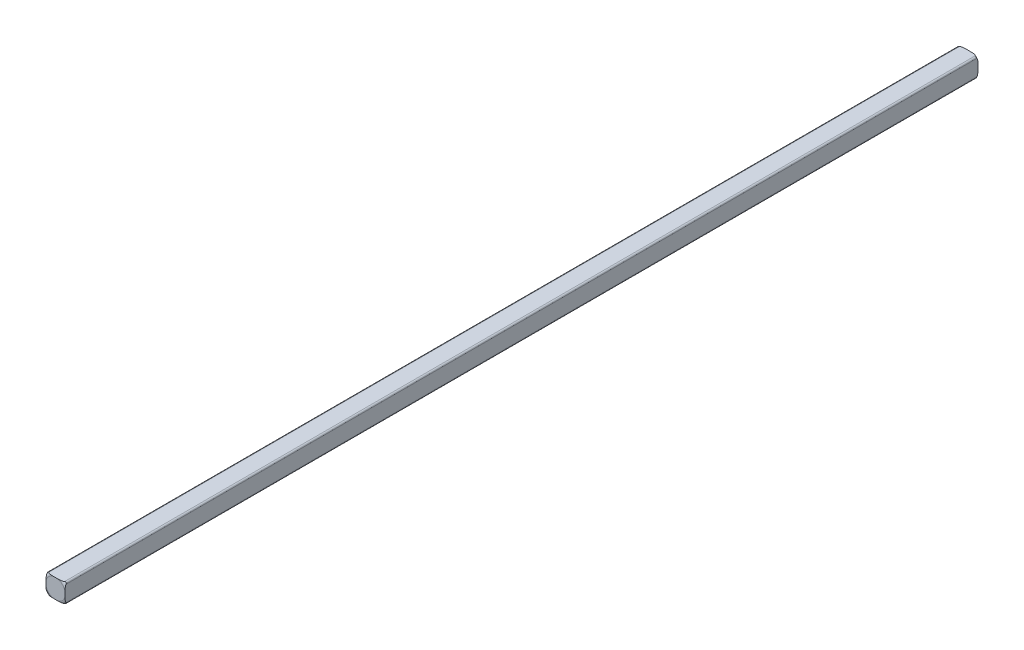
SolidWorks part; units mm, degrees
ref_plane "Front" through (0, 0, 0) normal (0, 0, 1) x (1, 0, 0)
ref_plane "Top" through (0, 0, 0) normal (0, 1, 0) x (1, 0, 0)
ref_plane "Right" through (0, 0, 0) normal (1, 0, 0) x (0, 0, -1)
imported_body "Imported3"
fillet "Fillet1" radius 0.254
sketch "Sketch1" plane through (0, 0, 0) normal (0, 1, 0) x (1, 0, 0)
  line L1 (6.21, -152.4) -> (-13.2647, -152.4)
  line L2 (6.21, -152.4) -> (6.21, -76.2)
  line L3 (6.21, -76.2) -> (-13.2647, -76.2)
  line L4 (-13.2647, -152.4) -> (-13.2647, -76.2)
  line L5 (-13.2647, -76.2) -> (13.7616, -76.2)
  line L6 (-13.2647, -76.2) -> (-13.2647, 221.1319)
  line L7 (-13.2647, 221.1319) -> (13.7616, 221.1319)
  line L8 (13.7616, -76.2) -> (13.7616, 221.1319)
  dimension "D1" = 76.2
extrude "Cut-Extrude1" cut sketch "Sketch1" against normal through all both and the other way through all contours L5 L8 L7 L6 L3
mirror "Mirror1" about plane through (0, -2.0879, 76.2) normal (0, 0, 1)
